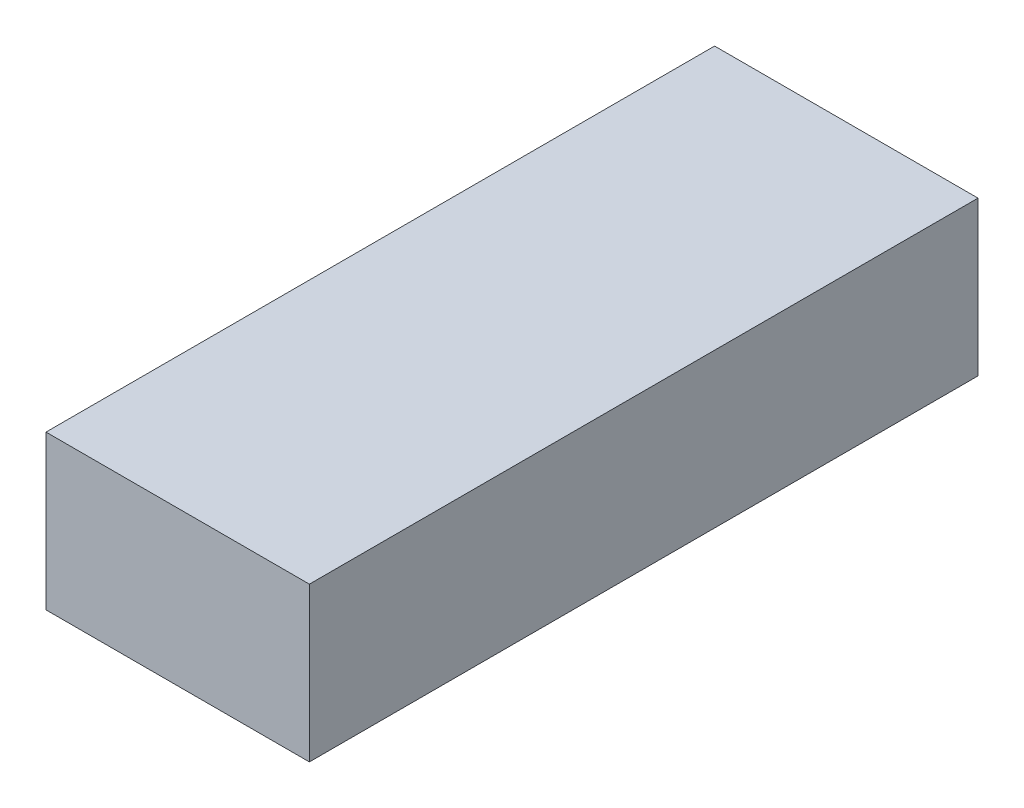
SolidWorks part; units mm, degrees
ref_plane "Front Plane" through (0, 0, 0) normal (0, 0, 1) x (1, 0, 0)
ref_plane "Top Plane" through (0, 0, 0) normal (0, 1, 0) x (1, 0, 0)
ref_plane "Right Plane" through (0, 0, 0) normal (1, 0, 0) x (0, 0, -1)
sketch "Sketch1" plane through (0, 0, 0) normal (0, 0, 1) x (1, 0, 0)
  line L1 (0, 0) -> (-65, 0)
  line L2 (0, 0) -> (0, 38)
  line L3 (0, 38) -> (-65, 38)
  line L4 (-65, 0) -> (-65, 38)
  dimension "D1" = 38
  dimension "D2" = 65
extrude "Boss-Extrude1" add sketch "Sketch1" along normal blind 165
